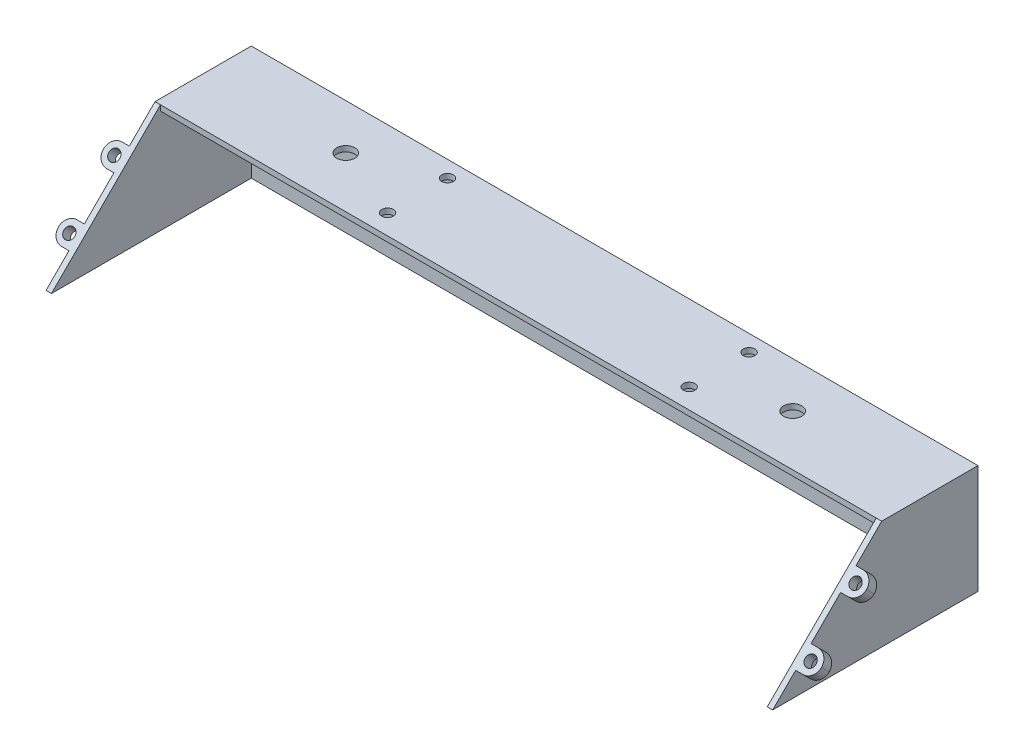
SolidWorks part; units mm, degrees
ref_plane "Plan de face" through (0, 0, 0) normal (0, 0, 1) x (1, 0, 0)
ref_plane "Plan de dessus" through (0, 0, 0) normal (0, 1, 0) x (1, 0, 0)
ref_plane "Plan de droite" through (0, 0, 0) normal (1, 0, 0) x (0, 0, -1)
sketch "Esquisse1" plane through (0, 0, 0) normal (0, 0, 1) x (1, 0, 0)
  line L1 (-100, 15) -> (100, 15)
  line L2 (-100, 15) -> (-100, -15)
  line L3 (-100, -15) -> (100, -15)
  line L4 (100, 15) -> (100, -15)
  dimension "D1" = 30
  dimension "D2" = 200
  dimension "D3" = 15
  dimension "D4" = 100
extrude "Boss.-Extru.1" add sketch "Esquisse1" along normal blind 1.5
sketch "Esquisse2" plane through (0, 0, 1.5) normal (0, 0, 1) x (1, 0, 0)
  line L1 (-100, 15) -> (100, 15)
  line L2 (-100, 15) -> (-100, 13.5)
  line L3 (-100, 13.5) -> (100, 13.5)
  line L4 (100, 15) -> (100, 13.5)
  line L5 (100, -15) -> (100, 15) construction
  dimension "D1" = 1.5
  dimension "D2" = 200
extrude "Boss.-Extru.2" add sketch "Esquisse2" along normal blind 25
sketch "Esquisse4" plane through (0, 13.5, 0) normal (0, -1, 0) x (1, 0, 0)
  line L1 (-100, 26.5) -> (-98.5, 26.5)
  line L2 (-100, 26.5) -> (-100, 1.5)
  line L3 (-100, 1.5) -> (-98.5, 1.5)
  line L4 (-98.5, 26.5) -> (-98.5, 1.5)
  line L5 (-100, 1.5) -> (100, 1.5) construction
  dimension "D1" = 25
  dimension "D2" = 1.5
extrude "Boss.-Extru.3" add sketch "Esquisse4" along normal blind 28.5
mirror "Symétrie2" about plane through (0, 0, 0) normal (1, 0, 0) of "Boss.-Extru.1", "Boss.-Extru.3"
sketch "Esquisse5" plane through (0, 13.5, 0) normal (0, -1, 0) x (1, 0, 0)
  line L0 (98.5, 1.5) -> (98.5, 26.5) construction
  line L1 (-98.5, 1.5) -> (98.5, 1.5) construction
  circle A0 centre (61.5, 12.5) radius 2.5
  dimension "D1" = 37
  dimension "D2" = 11
  dimension "D3" = 5
extrude "Enlèv. mat.-Extru.1" cut sketch "Esquisse5" against normal blind 5.5
sketch "Esquisse6" plane through (0, 13.5, 0) normal (0, -1, 0) x (1, 0, 0)
  line L2 (-98.5, 1.5) -> (98.5, 1.5) construction
  circle A0 centre (41.5, 21) radius 1.6
  circle A1 centre (41.5, 4.5) radius 1.6
  circle A2 centre (61.5, 12.5) radius 2.5 construction
  dimension "D1" = 20
  dimension "D2" = 20
  dimension "D3" = 3.2
  dimension "D4" = 3.2
  dimension "D5" = 3
  dimension "D6" = 16.5
extrude "Enlèv. mat.-Extru.2" cut sketch "Esquisse6" against normal blind 10
sketch "Esquisse14" plane through (100, 0, 0) normal (1, 0, 0) x (0, 0, -1)
  line L0 (-26.5, -15) -> (-56.5, -15)
  line L1 (-56.5, -15) -> (-26.5, 15)
  line L2 (-26.5, 15) -> (-26.5, -15)
  dimension "D1" = 30
extrude "Boss.-Extru.7" add sketch "Esquisse14" against normal blind 1.5
mirror "Symétrie5" about plane through (0, 0, 0) normal (1, 0, 0) of "Boss.-Extru.7"
sketch "Esquisse15" plane through (-100, 0, 0) normal (-1, 0, 0) x (0, 0, 1)
  line L0 (33.5711, 7.9289) -> (37.8137, 3.6863)
  line L1 (26.5, 15) -> (56.5, -15) construction
  line L2 (37.8137, 3.6863) -> (35.6924, 1.565)
  line L3 (35.6924, 1.565) -> (31.4497, 5.8076)
  line L4 (31.4497, 5.8076) -> (33.5711, 7.9289)
  dimension "D1" = 6
  dimension "D2" = 3
  dimension "D3" = 10
extrude "Boss.-Extru.8" add sketch "Esquisse15" along normal blind 5
fillet "Congé5" radius 3 2 edges at (-105, 2.6256, 36.753) (-105, 6.8683, 32.5104)
sketch "Esquisse17" plane through (0, 20.75, 20.75) normal (0, 0.7071, 0.7071) x (1, 0, 0)
  circle A0 centre (-102, -21.1317) radius 1.5
  arc A1 (-102, -18.1317) -> (-105, -21.1317) centre (-102, -21.1317) ccw construction
  dimension "D1" = 3
extrude "Enlèv. mat.-Extru.6" cut sketch "Esquisse17" against normal blind 5
sketch "Esquisse18" plane through (-100, 0, 0) normal (-1, 0, 0) x (0, 0, 1)
  line L0 (45.9506, -4.4506) -> (50.1932, -8.6932)
  line L1 (37.8137, 3.6863) -> (56.5, -15) construction
  line L2 (50.1932, -8.6932) -> (48.0719, -10.8145)
  line L3 (48.0719, -10.8145) -> (43.8292, -6.5719)
  line L4 (43.8292, -6.5719) -> (45.9506, -4.4506)
  dimension "D1" = 6
  dimension "D2" = 3
extrude "Boss.-Extru.9" add sketch "Esquisse18" along normal blind 5
fillet "Congé6" radius 3 2 edges at (-105, -9.7539, 49.1325) (-105, -5.5112, 44.8899)
sketch "Esquisse19" plane through (0, 20.75, 20.75) normal (0, 0.7071, 0.7071) x (1, 0, 0)
  circle A0 centre (-102, -38.639) radius 1.5
  arc A1 (-102, -35.639) -> (-105, -38.639) centre (-102, -38.639) ccw construction
  dimension "D1" = 3
extrude "Enlèv. mat.-Extru.7" cut sketch "Esquisse19" against normal blind 5 contours A0
mirror "Symétrie6" about plane through (0, 0, 0) normal (1, 0, 0) of "Boss.-Extru.9", "Congé6", "Enlèv. mat.-Extru.7", "Congé5", "Enlèv. mat.-Extru.6", "Boss.-Extru.8"
mirror "Symétrie7" about plane through (0, 0, 0) normal (1, 0, 0) of "Enlèv. mat.-Extru.2", "Enlèv. mat.-Extru.1"
